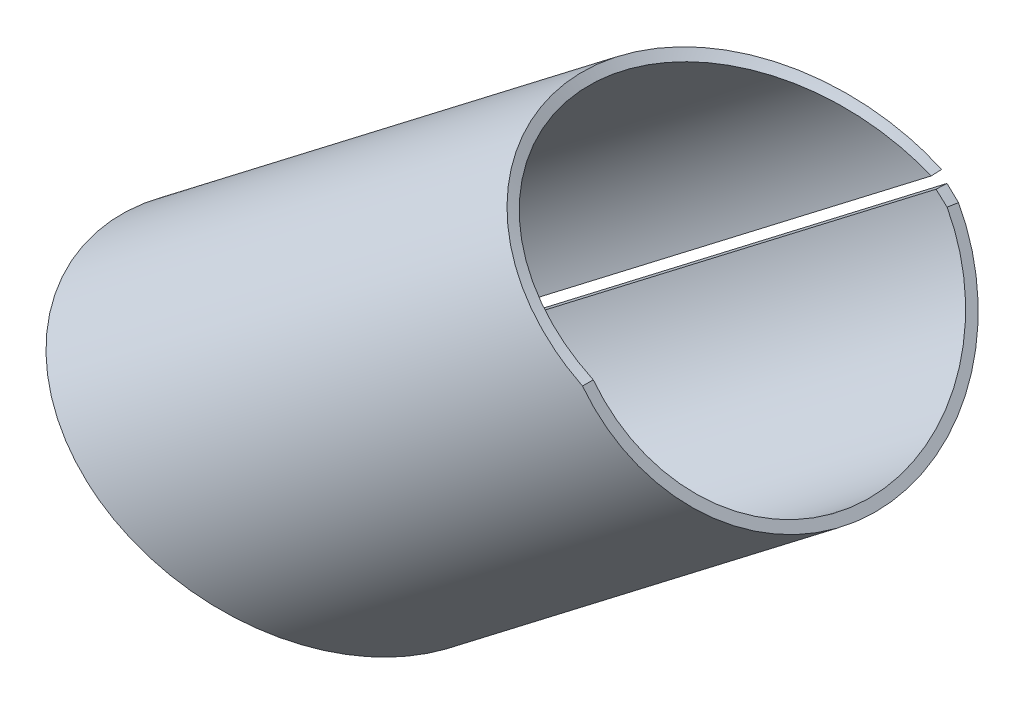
SolidWorks part; units mm, degrees
ref_plane "前视基准面" through (0, 0, 0) normal (0, 0, 1) x (1, 0, 0)
ref_plane "上视基准面" through (0, 0, 0) normal (0, 1, 0) x (1, 0, 0)
ref_plane "右视基准面" through (0, 0, 0) normal (1, 0, 0) x (0, 0, -1)
imported_body "基体零件-长短脚任意角度裤形三通管-1"
sheet metal parameters "钣金1" parameters "D1"=0.7366, "厚度"=1
bend "圆角折弯1" bend radius 15.9772 bend angle 356.625 parameters "D5"=1
flatten bends "展开-折弯1"
sketch "尖角-草图1" plane through (-21.9689, -16.2319, -16.9698) normal (-0.0179, 0.0234, -0.9996) x (-0.9998, -0.0004, 0.0179)
  line L0 (8.8489, 55.8823) -> (51.5435, 23.1264) construction
  dimension "D1" = 0
process bends "加工-折弯1" parameters "D1"=0
sketch "平面-草图1" plane through (-21.9689, -16.2319, -16.9698) normal (-0.0179, 0.0234, -0.9996) x (-0.9998, -0.0004, 0.0179)
